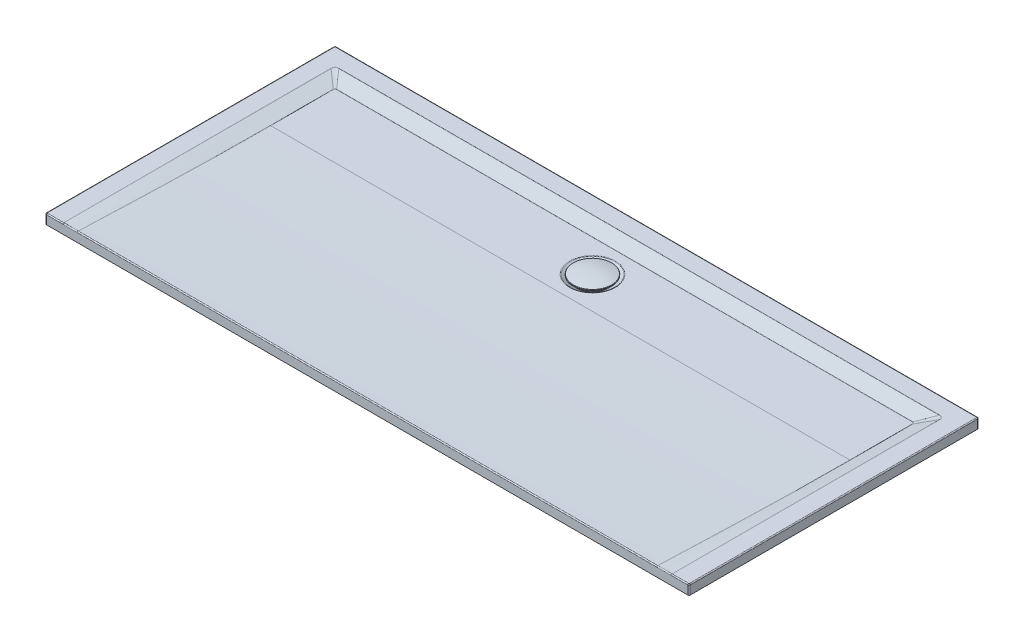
SolidWorks part; units mm, degrees
ref_plane "Płaszczyzna przednia" through (0, 0, 0) normal (0, 0, 1) x (1, 0, 0)
ref_plane "Płaszczyzna górna" through (0, 0, 0) normal (0, 1, 0) x (1, 0, 0)
ref_plane "Płaszczyzna prawa" through (0, 0, 0) normal (1, 0, 0) x (0, 0, -1)
sketch "Szkic1" plane through (0, 0, 0) normal (0, 1, 0) x (1, 0, 0)
  line L0 (0, 450) -> (0, -450) construction
  line L1 (-1000, 450) -> (1000, 450)
  line L2 (-1000, 450) -> (-1000, -450)
  line L3 (-1000, -450) -> (1000, -450)
  line L4 (1000, 450) -> (1000, -450)
  line L5 (-945, -450) -> (-945, 395)
  line L6 (-945, 395) -> (945, 395)
  line L7 (945, 395) -> (945, -450)
  line L8 (-900, -450) -> (-900, 350)
  line L9 (-900, 350) -> (900, 350)
  line L10 (900, 350) -> (900, -450)
  circle A0 centre (0, 250) radius 45
  circle A1 centre (0, 250) radius 70
  point P9 (0, 395)
  dimension "D6" = 90
  dimension "D7" = 140
  dimension "D1" = 2000
  dimension "D2" = 55
  dimension "D3" = 55
  dimension "D5" = 200
  dimension "D8" = 900
  dimension "D4" = 45
sketch "Szkic2" plane through (0, 0, 0) normal (0, 1, 0) x (1, 0, 0)
  line L0 (-1000, -450) -> (1000, -450) construction
  line L1 (1000, 450) -> (1000, -450) construction
  line L2 (945, 395) -> (945, -450) construction
  line L3 (-945, 395) -> (945, 395) construction
  line L4 (-1000, 450) -> (1000, 450) construction
  line L5 (-945, -450) -> (-945, 395) construction
  line L6 (-1000, 450) -> (-1000, -450) construction
  line L7 (-1000, -450) -> (-945, -450)
  line L8 (1000, 450) -> (1000, -450)
  line L9 (945, 395) -> (945, -450)
  line L10 (-945, 395) -> (945, 395)
  line L11 (-1000, 450) -> (1000, 450)
  line L12 (-945, -450) -> (-945, 395)
  line L13 (-1000, 450) -> (-1000, -450)
  line L14 (945, -450) -> (1000, -450)
surface "Powierzchnia-Płaszczyzna1" sketch "Szkic2"
ref_plane "Płaszczyzna1" through (0, -15, 0) normal (0, 1, 0) x (-1, 0, 0)
sketch "Szkic3" plane through (0, -15, 0) normal (0, 1, 0) x (-1, 0, 0)
  line L0 (900, -150) -> (-900, -150)
  line L1 (900, 450) -> (900, -350) construction
  line L2 (-900, -350) -> (-900, 450) construction
  line L3 (0, -150) -> (0, -350) construction
  line L4 (900, -350) -> (-900, -350) construction
  line L5 (-900, -350) -> (-900, -150)
  line L6 (900, -150) -> (900, -350)
  line L7 (900, -350) -> (-900, -350)
  circle A0 centre (0, -250) radius 70 construction
  circle A1 centre (0, -250) radius 70
  point P10 (0, -250)
surface "Powierzchnia-Płaszczyzna2" sketch "Szkic3"
sketch "Szkic4" plane through (0, 0, 0) normal (0, 1, 0) x (1, 0, 0)
  line L0 (900, -450) -> (-900, -450)
other "Granica-Powierzchnia1"
other "Granica-Powierzchnia2"
other "Granica-Powierzchnia3"
mirror "Lustro1" about plane through (0, 0, 0) normal (1, 0, 0)
sketch "Szkic5" plane through (0, 0, 0) normal (0, 1, 0) x (1, 0, 0)
  line L0 (1000, 450) -> (1000, -450) construction
  line L1 (-1000, 450) -> (1000, 450) construction
  line L2 (-1000, 450) -> (-1000, -450) construction
  line L3 (-1000, -450) -> (1000, -450) construction
  line L4 (1000, 450) -> (1000, -450)
  line L5 (-1000, 450) -> (1000, 450)
  line L6 (-1000, 450) -> (-1000, -450)
  line L7 (-1000, -450) -> (1000, -450)
surface "Powierzchnia-Wyciągnięcie1" sketch "Szkic5" parameters "D1"=30
sketch "Szkic7" plane through (0, 0, 0) normal (1, 0, 0) x (0, 0, -1)
  line L0 (250, 0) -> (250, -30) construction
  line L1 (450, -30) -> (-450, -30) construction
  line L2 (295, -30) -> (295, -28)
  line L3 (295, -28) -> (299, -28)
  line L6 (299, -28) -> (320, -15)
  dimension "D1" = 90
  dimension "D2" = 2
  dimension "D3" = 98
surface "Powierzchnia-Obrót wokół linii środkowej1" sketch "Szkic7" parameters "D1"=360
surface "Powierzchnia-Płaszczyzna3"
surface "Powierzchnia-Połącz1"
fillet "Zaokrąglenie1" radius 4 6 edges at (0, -28, -299) (0, -15, -180) (1000, -15, 450) (1000, -15, -450) (-1000, -15, -450) (-1000, -15, 450)
fillet "Zmienne zaokrąglenie1" radius 40 2 edges at (922.5, -7.5, -372.5)
fillet "Zaokrąglenie3" radius 3 12 edges
fillet "Zaokrąglenie4" radius 3 12 edges at (-998.8284, 0, -448.8284) (0, 0, -450) (998.8284, 0, -448.8284) (1000, 0, 0) (998.8284, 0, 448.8284) (970.5, 0, 450) (-970.5, 0, 450) (-998.8284, 0, 448.8284) (-1000, 0, 0)
sketch "Szkic8" plane through (0, 0, 0) normal (1, 0, 0) x (0, 0, -1)
  line L0 (250, 0) -> (250, -30) construction
  line L1 (250, -5.6601) -> (179.8469, -5.6601) construction
  line L2 (310, -14.7573) -> (310, -17)
  line L3 (310, -17) -> (250, -17)
  line L4 (250, -17) -> (250, -5.6601)
  line L5 (250, -5.6601) -> (199.9922, 95.6514)
  arc A0 (250, -5.6601) -> (309.2694, -13.7943) centre (250, -225.6601) cw
  arc A1 (309.2694, -13.7943) -> (310, -14.7573) centre (309, -14.7573) cw
  point P11 (310, -14)
  dimension "D1" = 220
  dimension "D4" = 1
  dimension "D2" = 60
  dimension "D3" = 3
  dimension "D5" = 13
revolve "Obrót wokół linii środkowej1" add sketch "Szkic8" angle 360 about L4
